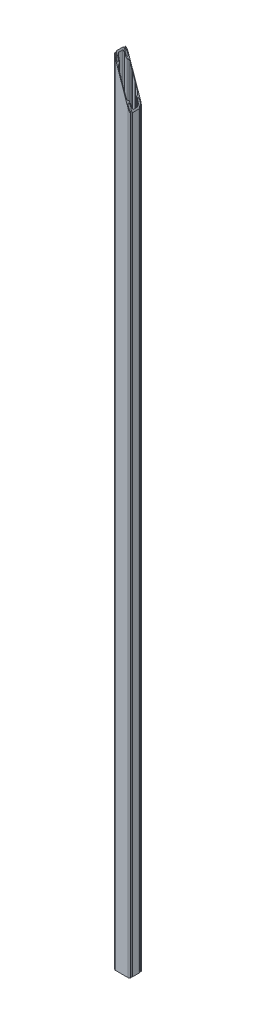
SolidWorks part; units mm, degrees
ref_plane "Alzado" through (0, 0, 0) normal (0, 0, 1) x (1, 0, 0)
ref_plane "Planta" through (0, 0, 0) normal (0, 1, 0) x (1, 0, 0)
ref_plane "Vista lateral" through (0, 0, 0) normal (1, 0, 0) x (0, 0, -1)
sketch "Croquis1" plane through (0, 0, 0) normal (0, 1, 0) x (1, 0, 0)
  line L0 (0, -75.4262) -> (0, 70.5479) construction
  line L1 (-123.9156, -11.6543) -> (129.4204, -11.6543) construction
  line L6 (39.5, 1.486) -> (39.5, 34.9397) construction
  line L7 (19.5039, 17.8457) -> (63.5704, 17.8457) construction
  line L9 (46, -42.8837) -> (46, -42.6992)
  line L10 (22.5, 24.3457) -> (12.5, 24.3457)
  line L12 (39.5, 17.8457) -> (50.0765, 20.3595) construction
  line L13 (47.3463, 21.5924) -> (48.0388, 18.6787) construction
  line L14 (47.3463, -44.9011) -> (48.0388, -41.9874) construction
  line L15 (39.5, -41.1543) -> (50.0765, -43.6682) construction
  line L16 (19.5039, -41.1543) -> (63.5704, -41.1543) construction
  line L17 (39.5, -24.7947) -> (39.5, -58.2483) construction
  line L19 (46, 19.5751) -> (46, 19.3906)
  line L20 (39.5, -51.6543) -> (-39.5, -51.6543)
  line L21 (11, 22.8457) -> (12.5, 24.3457)
  line L22 (46, -24.1543) -> (46, 0.8457)
  line L23 (50, -31.9348) -> (50, 8.6261)
  line L24 (-39.5, -24.7947) -> (-39.5, -58.2483) construction
  line L25 (-19.5039, -41.1543) -> (-63.5704, -41.1543) construction
  line L26 (-39.5, -41.1543) -> (-50.0765, -43.6682) construction
  line L27 (-47.3463, -44.9011) -> (-48.0388, -41.9874) construction
  line L28 (-47.3463, 21.5924) -> (-48.0388, 18.6787) construction
  line L29 (-39.5, 17.8457) -> (-50.0765, 20.3595) construction
  line L30 (-19.5039, 17.8457) -> (-63.5704, 17.8457) construction
  line L31 (-39.5, 1.486) -> (-39.5, 34.9397) construction
  line L32 (123.9156, -11.6543) -> (-129.4204, -11.6543) construction
  line L33 (-50, -31.9348) -> (-50, 8.6261)
  line L34 (-46, -24.1543) -> (-46, 0.8457)
  line L35 (-50, 28.3457) -> (-50, -31.9348)
  line L36 (-39.5, -51.6543) -> (39.5, -51.6543)
  line L38 (-22.5, -47.6543) -> (-12.5, -47.6543)
  line L39 (-22.5, 24.3457) -> (-12.5, 24.3457)
  line L40 (-46, -42.8837) -> (-46, -42.6992)
  line L41 (-39.5, 28.3457) -> (39.5, 28.3457)
  line L42 (46, 0.8457) -> (46, -24.1543)
  line L43 (50, 8.6261) -> (50, -31.9348)
  line L44 (8, 22.8457) -> (6.5, 24.3457)
  line L45 (11, 22.8457) -> (8, 22.8457)
  line L46 (-11, 22.8457) -> (-8, 22.8457)
  line L47 (-8, 22.8457) -> (-6.5, 24.3457)
  line L48 (-11, 22.8457) -> (-12.5, 24.3457)
  line L49 (11, -46.1543) -> (8, -46.1543)
  line L50 (8, -46.1543) -> (6.5, -47.6543)
  line L51 (11, -46.1543) -> (12.5, -47.6543)
  line L52 (-11, -46.1543) -> (-12.5, -47.6543)
  line L53 (-8, -46.1543) -> (-6.5, -47.6543)
  line L54 (-11, -46.1543) -> (-8, -46.1543)
  line L55 (-6.5, -47.6543) -> (6.5, -47.6543)
  line L56 (12.5, -47.6543) -> (22.5, -47.6543)
  line L57 (-12.5, 24.3457) -> (-22.5, 24.3457)
  line L58 (6.5, 24.3457) -> (-6.5, 24.3457)
  line L59 (-6.5, 24.3457) -> (6.5, 24.3457)
  line L60 (12.5, 24.3457) -> (22.5, 24.3457)
  line L61 (-46, 0.8457) -> (-46, -24.1543)
  arc A0 (49.242, 21.7627) -> (39.5, 28.3457) centre (39.5, 17.8457) ccw
  arc A1 (45.5308, 20.2705) -> (43.0455, 12.3978) centre (39.5, 17.8457) ccw
  arc A5 (45.5308, 20.2705) -> (49.242, 21.7627) centre (47.3864, 21.0166) ccw
  arc A6 (29, 17.8457) -> (22.5, 24.3457) centre (22.5, 17.8457) ccw
  arc A7 (46, 0.8457) -> (39.5, 7.3457) centre (39.5, 0.8457) ccw
  arc A9 (50, 8.6261) -> (43.0455, 12.3978) centre (45.5, 8.6261) ccw
  arc A10 (50, -31.9348) -> (43.0455, -35.7064) centre (45.5, -31.9348) cw
  arc A11 (46, -24.1543) -> (39.5, -30.6543) centre (39.5, -24.1543) cw
  arc A12 (29, -41.1543) -> (22.5, -47.6543) centre (22.5, -41.1543) cw
  arc A13 (45.5308, -43.5791) -> (49.242, -45.0713) centre (47.3864, -44.3252) cw
  arc A14 (45.5308, -43.5791) -> (43.0455, -35.7064) centre (39.5, -41.1543) cw
  arc A15 (49.242, -45.0713) -> (39.5, -51.6543) centre (39.5, -41.1543) cw
  arc A16 (29, -41.1543) -> (39.5, -30.6543) centre (39.5, -41.1543) cw
  arc A17 (29, 17.8457) -> (39.5, 7.3457) centre (39.5, 17.8457) ccw
  arc A18 (-29, 17.8457) -> (-39.5, 7.3457) centre (-39.5, 17.8457) cw
  arc A19 (-29, -41.1543) -> (-39.5, -30.6543) centre (-39.5, -41.1543) ccw
  arc A20 (-49.242, -45.0713) -> (-39.5, -51.6543) centre (-39.5, -41.1543) ccw
  arc A21 (-45.5308, -43.5791) -> (-43.0455, -35.7064) centre (-39.5, -41.1543) ccw
  arc A22 (-45.5308, -43.5791) -> (-49.242, -45.0713) centre (-47.3864, -44.3252) ccw
  arc A23 (-29, -41.1543) -> (-22.5, -47.6543) centre (-22.5, -41.1543) ccw
  arc A24 (-46, -24.1543) -> (-39.5, -30.6543) centre (-39.5, -24.1543) ccw
  arc A25 (-50, -31.9348) -> (-43.0455, -35.7064) centre (-45.5, -31.9348) ccw
  arc A26 (-50, 8.6261) -> (-43.0455, 12.3978) centre (-45.5, 8.6261) cw
  arc A27 (-46, 0.8457) -> (-39.5, 7.3457) centre (-39.5, 0.8457) cw
  arc A28 (-29, 17.8457) -> (-22.5, 24.3457) centre (-22.5, 17.8457) cw
  arc A29 (-45.5308, 20.2705) -> (-49.242, 21.7627) centre (-47.3864, 21.0166) cw
  arc A30 (-45.5308, 20.2705) -> (-43.0455, 12.3978) centre (-39.5, 17.8457) cw
  arc A31 (-49.242, 21.7627) -> (-39.5, 28.3457) centre (-39.5, 17.8457) cw
  dimension "D8" = 2
  dimension "D9" = 13
  dimension "D12" = 4.5
  dimension "D2" = 8
  dimension "D3" = 11.6543
  dimension "D4" = 3
  dimension "D5" = 45
  dimension "D6" = 45
  dimension "D10" = 13.37
  dimension "D11" = 8.5
  dimension "D13" = 3.1709
  dimension "D14" = 9.2195
extrude "Saliente-Extruir1" add sketch "Croquis1" along normal blind 5000 contours A31 A29 A30 A26 L33 A25 A21 A22 A20 L20 A15 A13 A14 A10 L23 A9 A1 A5 A0 L41 A18 A28 L39 L48 L46 L47 L58 L44 L45 L21 L10 A6 A17 A7 L22 A11 A16 A12 L56 L51 L49 L50 L55 L53 L54 L52 L38
sketch "Croquis2" plane through (0, 0, 51.6543) normal (0, 0, 1) x (1, 0, 0)
  line L0 (-50, 5000) -> (-49.242, 4772.6303) construction
  line L1 (-49.242, 5000) -> (-49.242, 0) construction
  line L2 (-50, 5000) -> (191.6317, 5000) construction
  line L3 (-50, 5000) -> (50, 4711.5429)
  line L5 (-50, 5000) -> (50, 5000)
  line L7 (50, 5000) -> (50, 0) construction
  line L8 (50, 5000) -> (50, 4711.5429)
  dimension "D1" = 70.88
extrude "Cortar-Extruir1" cut sketch "Croquis2" against normal through all
